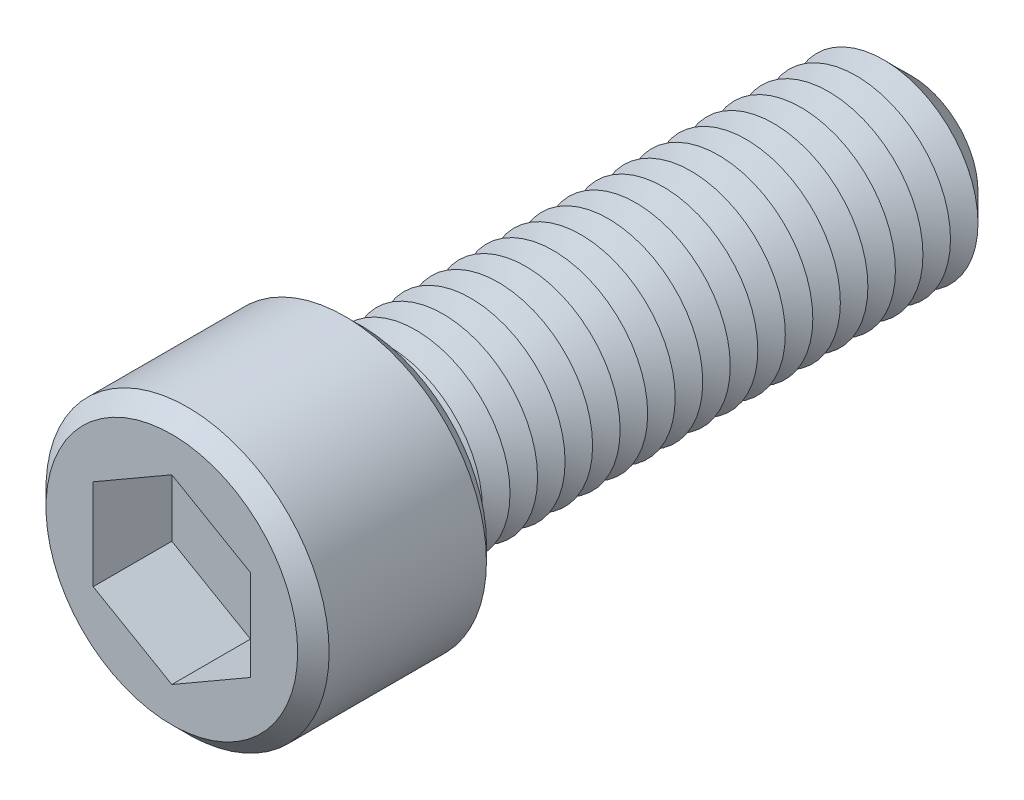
SolidWorks part; units mm, degrees
ref_plane "Front Plane" through (0, 0, 0) normal (0, 0, 1) x (1, 0, 0)
ref_plane "Top Plane" through (0, 0, 0) normal (0, 1, 0) x (1, 0, 0)
ref_plane "Right Plane" through (0, 0, 0) normal (1, 0, 0) x (0, 0, -1)
sketch "Sketch1" plane through (0, 0, 0) normal (0, 0, 1) x (1, 0, 0)
  circle A0 centre (0, 0) radius 9
  dimension "D1" = 18
extrude "Boss-Extrude1" add sketch "Sketch1" along normal blind 12
sketch "Sketch2" plane through (0, 0, 0) normal (0, 0, -1) x (-1, 0, 0)
  circle A0 centre (0, 0) radius 6
  dimension "D1" = 12
extrude "Boss-Extrude2" add sketch "Sketch2" along normal blind 35
chamfer "Chamfer1" distance 1.75 angle 45 1 edges at (-6, 0, -35)
sketch "Sketch3" plane through (0, 0, 0) normal (1, 0, 0) x (0, 0, -1)
  line L0 (-2.5121, 0) -> (4.5776, 0) construction
sketch "Sketch4" plane through (0, 0, 0) normal (1, 0, 0) x (0, 0, -1)
  line L0 (0, 6) -> (0.875, 4.4845)
  line L1 (0.875, 4.4845) -> (1.75, 6)
  line L2 (33.25, 6) -> (0, 6) construction
  line L3 (1.75, 6) -> (0, 6)
  dimension "D1" = 1.75
revolve "Cut-Revolve1" cut sketch "Sketch4" angle 360 about L0
pattern_linear "LPattern1" count 19 spacing 1.75 along (0, 0, -1) of "Cut-Revolve1"
sketch "Sketch5" plane through (0, 0, 12) normal (0, 0, 1) x (1, 0, 0)
  line L1 (0, 5.7735) -> (-5, 2.8868)
  line L2 (-5, 2.8868) -> (-5, -2.8868)
  line L3 (-5, -2.8868) -> (0, -5.7735)
  line L4 (0, -5.7735) -> (5, -2.8868)
  line L5 (5, -2.8868) -> (5, 2.8868)
  line L6 (5, 2.8868) -> (0, 5.7735)
  circle A0 centre (0, 0) radius 5 construction
  dimension "D1" = 10
extrude "Cut-Extrude1" cut sketch "Sketch5" against normal blind 5
sketch "Sketch6" plane through (0, 0, 7) normal (0, 0, 1) x (1, 0, 0)
  circle A0 centre (0, 0) radius 0.9
  dimension "D1" = 1.8
extrude "Cut-Extrude2" cut sketch "Sketch6" against normal up to surface (42 mm away)
chamfer "Chamfer2" distance 1 angle 45 2 edges at (9, 0, 0) (9, 0, 12)
